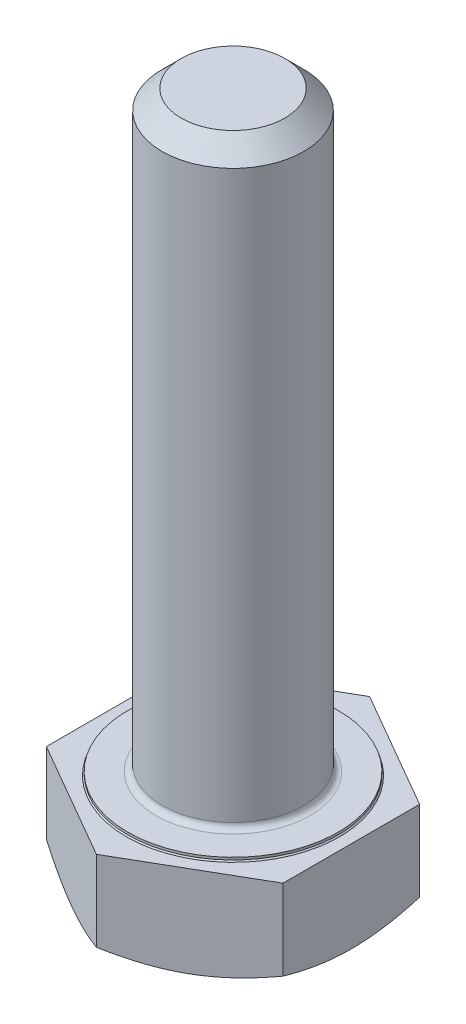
SolidWorks part; units mm, degrees
ref_plane "Plan de face" through (0, 0, 0) normal (0, 0, 1) x (1, 0, 0)
ref_plane "Plan de dessus" through (0, 0, 0) normal (0, 1, 0) x (1, 0, 0)
ref_plane "Plan de droite" through (0, 0, 0) normal (1, 0, 0) x (0, 0, -1)
imported_body "Importée3"
sketch "Esquisse1" plane through (0, -3.5534, 0) normal (0, 1, 0) x (-1, 0, 0)
  line L0 (5, 2.8868) -> (5, -2.8868)
  line L1 (5, -2.8868) -> (0, -5.7735)
  line L2 (0, -5.7735) -> (-5, -2.8868)
  line L3 (-5, -2.8868) -> (-5, 2.8868)
  line L4 (-5, 2.8868) -> (0, 5.7735)
  line L5 (0, 5.7735) -> (5, 2.8868)
extrude "Boss.-Extru.1" add sketch "Esquisse1" along normal blind 3.4034
sketch "Esquisse2" plane through (0, 0, 0) normal (0, 0, 1) x (1, 0, 0)
  line L0 (3, 25) -> (0, 25)
  line L1 (0, 25) -> (0, -0.15)
  line L2 (0, -0.15) -> (4.45, -0.15)
  line L3 (4.45, -0.15) -> (4.45, 0)
  line L4 (4.45, 0) -> (3, 0)
  line L5 (3, 0) -> (3, 25)
  line L6 (0, 25) -> (0, -0.15) construction
  dimension "D1" = 3
  dimension "D2" = 25
  dimension "D3" = 0.15
revolve "Révolution1" add sketch "Esquisse2" angle 360 about L6
chamfer "Chanfrein1" distance 0.8119 angle 45 1 edges at (0, 25, -3)
chamfer "Chanfrein2" distance 0.05 angle 45 1 edges at (0, -0.15, -4.45)
fillet "Congé1" radius 0.25 1 edges at (0, 0, -3)
